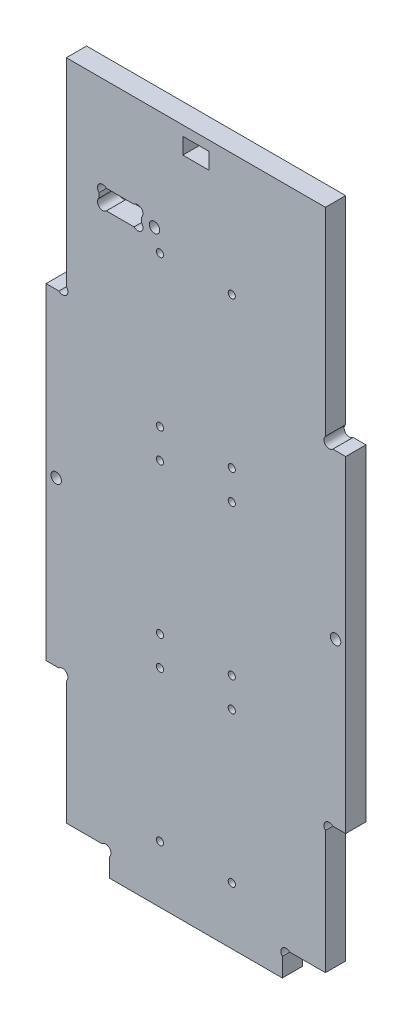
SolidWorks part; units mm, degrees
ref_plane "Face" through (0, 0, 0) normal (0, 0, 1) x (1, 0, 0)
ref_plane "Dessus" through (0, 0, 0) normal (0, 1, 0) x (1, 0, 0)
ref_plane "Droite" through (0, 0, 0) normal (1, 0, 0) x (0, 0, -1)
sketch "Esquisse1" plane through (0, 0, 0) normal (0, 0, 1) x (1, 0, 0)
  line L0 (45.875, -19.1604) -> (45.875, 202.0785) construction
  line L1 (-3.9379, 70) -> (121.8558, 70) construction
  line L2 (34.875, 173.3852) -> (34.875, 2.5385) construction
  line L3 (-28.0225, 213) -> (128.1766, 213) construction
  line L4 (68.5973, 120.5) -> (23.754, 120.5) construction
  line L5 (0, -19.1604) -> (0, 157.7904) construction
  line L6 (-28.0225, 0) -> (100.2626, 0) construction
  line L7 (-28.0225, 10) -> (148.8482, 10) construction
  line L8 (-14.0176, 50) -> (100.2626, 50) construction
  line L9 (-28.0225, 100) -> (100.2626, 100) construction
  line L10 (6.2, -34.6158) -> (6.2, 220.9577) construction
  line L11 (72.35, -34.6158) -> (72.35, 23.4146) construction
  line L12 (6.2, 50) -> (-6.9184, 36.8816) construction
  line L13 (6.2, 47.7373) -> (6.2, 10)
  line L14 (72.35, 10) -> (91.4659, -9.1159) construction
  line L15 (74.6127, 10) -> (85.55, 10)
  line L16 (3.9373, 50) -> (0, 50)
  line L17 (72.35, 7.7373) -> (72.35, 2)
  line L18 (17.1373, 10) -> (6.2, 10)
  line L19 (19.4, 7.7373) -> (19.4, 2)
  line L20 (85.55, 47.7373) -> (85.55, 10)
  line L21 (87.8127, 50) -> (91.75, 50)
  line L22 (-28.0225, 150) -> (128.1766, 150) construction
  line L23 (3.9373, 150) -> (0, 150)
  line L24 (85.55, -34.6158) -> (85.55, 220.9577) construction
  line L25 (87.8127, 150) -> (91.75, 150)
  line L26 (6.2, 152.2627) -> (6.2, 213)
  line L27 (3.1, 107.9737) -> (3.1, 97.91) construction
  line L28 (91.75, 50) -> (91.75, 150)
  line L30 (0, 50) -> (0, 150)
  line L31 (23.754, 125) -> (70.6409, 125) construction
  line L32 (29.2828, 210) -> (106.6224, 210) construction
  line L33 (6.2, 213) -> (85.55, 213)
  line L34 (29.2828, 205) -> (95.5377, 205) construction
  line L35 (16.2, 201.4578) -> (16.2, 173.3852) construction
  line L36 (41.875, 210) -> (49.875, 210)
  line L37 (49.875, 173.3852) -> (49.875, 217.1351) construction
  line L38 (41.875, 217.1351) -> (41.875, 173.3852) construction
  line L39 (41.875, 210) -> (41.875, 205)
  line L40 (41.875, 205) -> (49.875, 205)
  line L41 (49.875, 210) -> (49.875, 205)
  line L42 (85.55, 213) -> (85.55, 152.2627)
  line L43 (21.9764, 19.5) -> (68.5973, 19.5) construction
  line L44 (21.9764, 42.5) -> (53.1779, 42.5) construction
  line L45 (21.9764, 65.5) -> (68.5973, 65.5) construction
  line L46 (110.6548, 181.5) -> (-10.6885, 181.5) construction
  line L47 (-28.0225, 178.5) -> (64.9357, 178.5) construction
  line L48 (-28.0225, 184.5) -> (64.9357, 184.5) construction
  line L49 (22.7, 192.1151) -> (22.7, 188.7575) construction
  line L50 (16.2, 184.5) -> (26.0979, 174.6021) construction
  line L51 (16.2, 182.2373) -> (16.2, 180.7627)
  line L52 (18.4627, 178.5) -> (26.9373, 178.5)
  line L53 (29.2, 180.7627) -> (29.2, 182.2373)
  line L54 (26.9373, 184.5) -> (18.4627, 184.5)
  line L55 (29.2, 201.4578) -> (29.2, 188.7575) construction
  line L56 (33.2, 196.1976) -> (33.2, 179.6314) construction
  line L57 (13.2437, 2) -> (75.8151, 2) construction
  line L58 (19.4, 2) -> (72.35, 2)
  arc A0 (6.2, 47.7373) -> (3.9373, 50) centre (5.0686, 48.8686) ccw
  arc A1 (74.6127, 10) -> (72.35, 7.7373) centre (73.4814, 8.8686) ccw
  arc A2 (17.1373, 10) -> (19.4, 7.7373) centre (18.2686, 8.8686) cw
  arc A3 (85.55, 47.7373) -> (87.8127, 50) centre (86.6814, 48.8686) cw
  arc A4 (6.2, 152.2627) -> (3.9373, 150) centre (5.0686, 151.1314) cw
  arc A5 (85.55, 152.2627) -> (87.8127, 150) centre (86.6814, 151.1314) ccw
  circle A6 centre (3.1, 100) radius 1.6
  circle A7 centre (88.65, 100) radius 1.6
  circle A8 centre (56.875, 120.5) radius 1.1
  circle A9 centre (34.875, 120.5) radius 1.1
  circle A10 centre (34.875, 175.5) radius 1.1
  circle A11 centre (56.875, 175.5) radius 1.1
  circle A12 centre (34.875, 19.5) radius 1.1
  circle A13 centre (34.875, 65.5) radius 1.1
  circle A14 centre (56.875, 19.5) radius 1.1
  circle A15 centre (56.875, 65.5) radius 1.1
  circle A16 centre (56.875, 74.5) radius 1.1
  circle A17 centre (34.875, 74.5) radius 1.1
  circle A18 centre (34.875, 129.5) radius 1.1
  circle A19 centre (56.875, 129.5) radius 1.1
  arc A20 (18.4627, 184.5) -> (16.2, 182.2373) centre (17.3314, 183.3686) ccw
  arc A21 (18.4627, 178.5) -> (16.2, 180.7627) centre (17.3314, 179.6314) cw
  arc A22 (26.9373, 178.5) -> (29.2, 180.7627) centre (28.0686, 179.6314) ccw
  arc A23 (26.9373, 184.5) -> (29.2, 182.2373) centre (28.0686, 183.3686) cw
  circle A24 centre (33.2, 181.5) radius 1.6
  dimension "D7" = 45
  dimension "D8" = 3.1
  dimension "D9" = 4.5
  dimension "D13" = 5
  dimension "D19" = 3
  dimension "D22" = 6
  dimension "D26" = 13
  dimension "D28" = 8
  dimension "D2" = 6.2
  dimension "D3" = 10
  dimension "D4" = 40
  dimension "D5" = 90
  dimension "D6" = 45
  dimension "D10" = 11
  dimension "D11" = 4.5
  dimension "D12" = 13.2
  dimension "D14" = 63
  dimension "D15" = 4
  dimension "D16" = 8
  dimension "D17" = 31.5
  dimension "D18" = 3
  dimension "D20" = 9.5
  dimension "D21" = 23
  dimension "D23" = 10
  dimension "D24" = 6.5
  dimension "D25" = 45
  dimension "D27" = 4
extrude "Extrusion1" add sketch "Esquisse1" along normal blind 6.2
